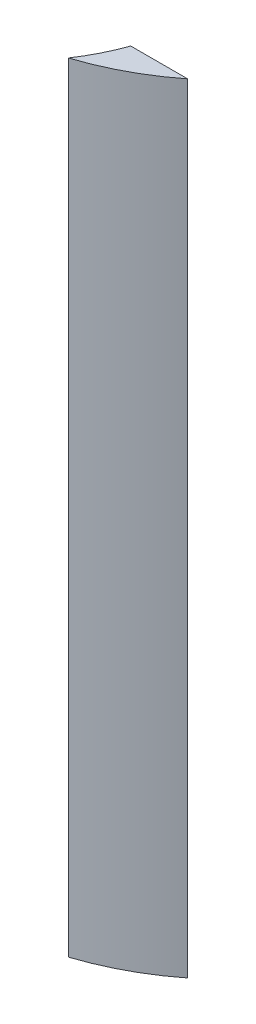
SolidWorks part; units mm, degrees
other "DetailItem1"
ref_plane "Front Plane" through (0, 0, 0) normal (0, 0, 1) x (1, 0, 0)
ref_plane "Top Plane" through (0, 0, 0) normal (0, 1, 0) x (1, 0, 0)
ref_plane "Right Plane" through (0, 0, 0) normal (1, 0, 0) x (0, 0, -1)
other "Weld Bead1"
